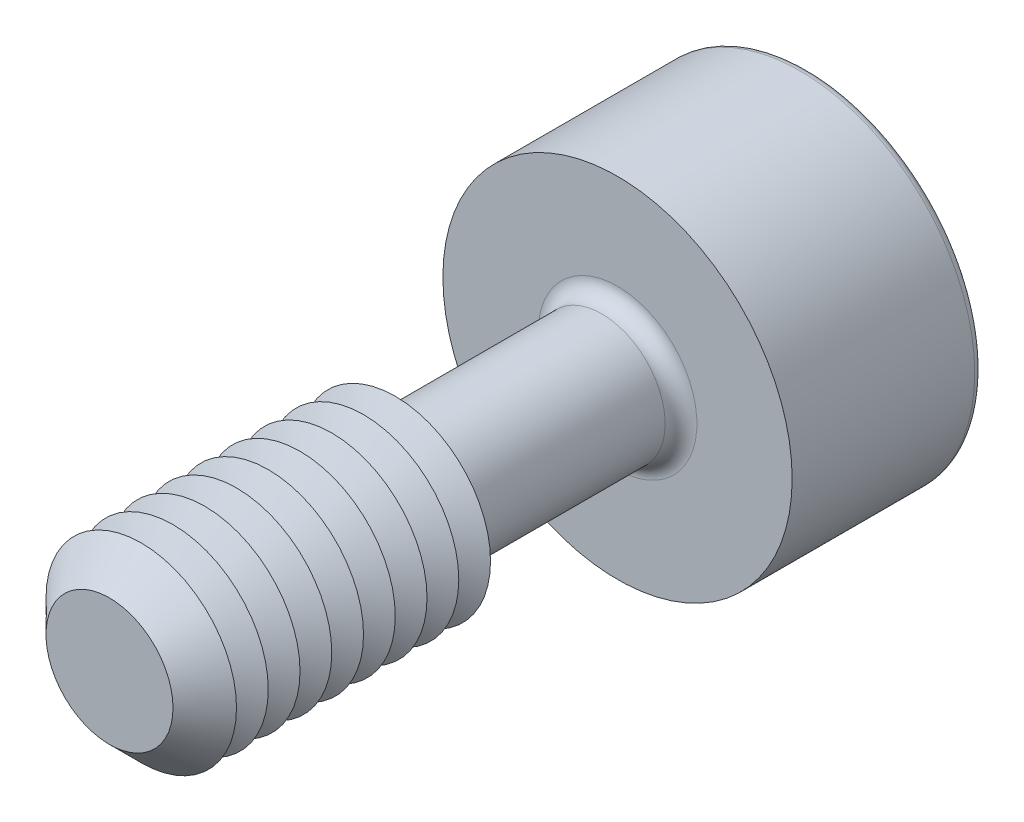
SolidWorks part; units mm, degrees
ref_plane "Front Plane" through (0, 0, 0) normal (0, 0, 1) x (1, 0, 0)
ref_plane "Top Plane" through (0, 0, 0) normal (0, 1, 0) x (1, 0, 0)
ref_plane "Right Plane" through (0, 0, 0) normal (1, 0, 0) x (0, 0, -1)
sketch "Sketch1" plane through (0, 0, 0) normal (0, 0, 1) x (1, 0, 0)
  circle A0 centre (0, 0) radius 1
  dimension "D1" = 2
extrude "Extrude1" add sketch "Sketch1" along normal mid plane 8
sketch "Sketch2" plane through (0, 0, 0) normal (1, 0, 0) x (0, 0, -1)
  line L0 (-4, 0) -> (-4, 1.5)
  line L1 (-4, 1) -> (-4, -1) construction
  line L2 (-4, 1.5) -> (0.5, 1.5)
  line L3 (0.5, 1.5) -> (0.7887, 1)
  line L4 (4, 1) -> (-4, 1) construction
  line L5 (0.7887, 1) -> (0.7887, 0)
  line L6 (0.7887, 0) -> (-4, 0)
  dimension "D1" = 1.5
  dimension "D2" = 120
  dimension "D3" = 4.5
revolve "Revolve1" add sketch "Sketch2" angle 360 about L6
chamfer "Chamfer1" distance 0.5 angle 45 1 edges at (0, 1.5, 4)
sketch "Sketch3" plane through (0, 0, -4) normal (0, 0, -1) x (-1, 0, 0)
  circle A0 centre (0, 0) radius 2.75
  dimension "D1" = 5.5
extrude "Extrude2" add sketch "Sketch3" along normal blind 3
sketch "Sketch4" plane through (-13.7, 0, -7) normal (0, 0, 1) x (1, 0, 0)
  line L2 (12.9783, -1.25) -> (14.4217, -1.25)
  line L3 (14.4217, -1.25) -> (15.1434, 0)
  line L4 (15.1434, 0) -> (14.4217, 1.25)
  line L6 (14.4217, 1.25) -> (12.9783, 1.25)
  line L7 (12.9783, 1.25) -> (12.2566, 0)
  line L8 (12.2566, 0) -> (12.9783, -1.25)
  circle A0 centre (13.7, 0) radius 1.25 construction
  dimension "D1" = 2.5
extrude "Extrude3" cut sketch "Sketch4" along normal blind 2.5
fillet "Fillet1" radius 0.25 1 edges at (-1, 0, -4)
fillet "Fillet2" radius 0.125 1 edges at (-2.75, 0, -7)
sketch "Sketch5" plane through (0, 0, 0) normal (1, 0, 0) x (0, 0, -1)
  line L0 (4.5, 0) -> (4.5, -1.25)
  line L1 (4.5, -1.25) -> (3.7783, 0)
  line L2 (3.7783, 0) -> (4.5, 0)
  dimension "D1" = 30
revolve "Cut-Revolve1" cut sketch "Sketch5" angle 360 about L2
sketch "Sketch6" plane through (0, 0, 0) normal (1, 0, 0) x (0, 0, -1)
  line L0 (1.332, 0) -> (-13.289, 0) construction
sketch "Sketch7" plane through (0, 0, 0) normal (1, 0, 0) x (0, 0, -1)
  line L0 (0.5, 1.5) -> (0.25, 1.067)
  line L1 (0.25, 1.067) -> (0, 1.5)
  line L2 (0.5, 1.5) -> (-3.5, 1.5) construction
  line L3 (0, 1.5) -> (0.5, 1.5)
  dimension "D1" = 0.5
revolve "Cut-Revolve2" cut sketch "Sketch7" angle 360 about L0
pattern_linear "LPattern1" count 8 spacing 0.5 along (0, 0, 1) of "Cut-Revolve2"
